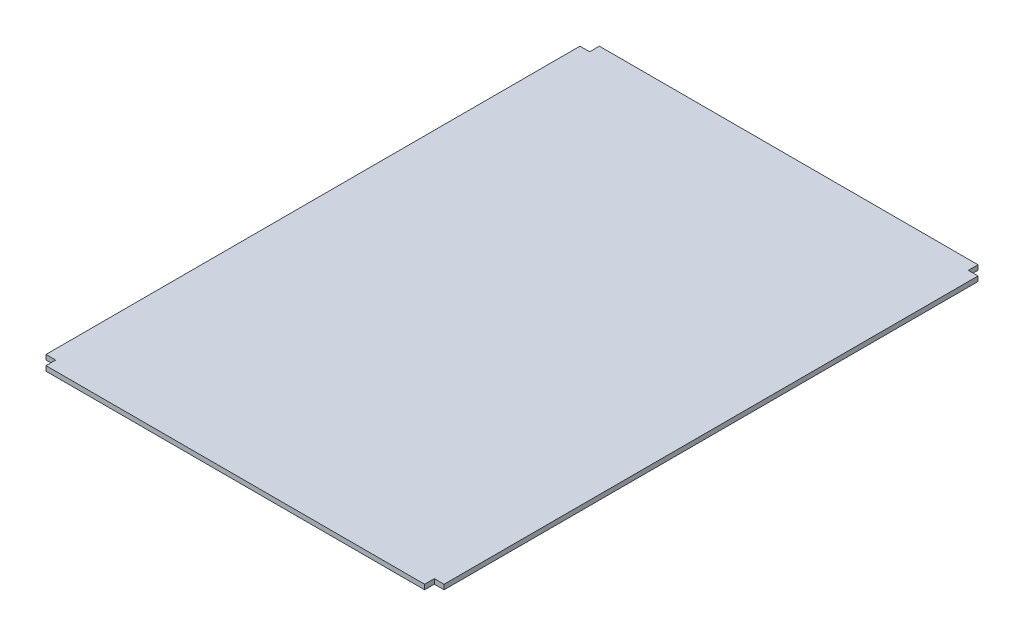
SolidWorks part; units mm, degrees
ref_plane "Front Plane" through (0, 0, 0) normal (0, 0, 1) x (1, 0, 0)
ref_plane "Top Plane" through (0, 0, 0) normal (0, 1, 0) x (1, 0, 0)
ref_plane "Right Plane" through (0, 0, 0) normal (1, 0, 0) x (0, 0, -1)
sketch "Sketch1" plane through (0, 0, 0) normal (0, 1, 0) x (1, 0, 0)
  line L1 (-260.35, -361.95) -> (260.35, -361.95)
  line L2 (-260.35, -361.95) -> (-260.35, 361.95)
  line L3 (-260.35, 361.95) -> (260.35, 361.95)
  line L4 (260.35, -361.95) -> (260.35, 361.95)
  line L5 (-260.35, -361.95) -> (260.35, 361.95) construction
  line L6 (-260.35, 361.95) -> (260.35, -361.95) construction
  point P0 (0, 0)
  dimension "D1" = 723.9
  dimension "D2" = 520.7
extrude "Boss-Extrude1" add sketch "Sketch1" along normal blind 6.35
sketch "Sketch2" plane through (0, 6.35, 0) normal (0, 1, 0) x (1, 0, 0)
  line L1 (-260.35, -361.95) -> (-247.65, -361.95)
  line L2 (-260.35, -361.95) -> (-260.35, -349.25)
  line L3 (-260.35, -349.25) -> (-247.65, -349.25)
  line L4 (-247.65, -361.95) -> (-247.65, -349.25)
  dimension "D1" = 12.7
  dimension "D2" = 12.7
extrude "Cut-Extrude1" cut sketch "Sketch2" against normal through all
sketch "Sketch3" plane through (0, 6.35, 0) normal (0, 1, 0) x (1, 0, 0)
  line L1 (260.35, -361.95) -> (247.65, -361.95)
  line L2 (260.35, -361.95) -> (260.35, -349.25)
  line L3 (260.35, -349.25) -> (247.65, -349.25)
  line L4 (247.65, -361.95) -> (247.65, -349.25)
  line L5 (260.35, 361.95) -> (247.65, 361.95)
  line L6 (260.35, 361.95) -> (260.35, 349.25)
  line L7 (260.35, 349.25) -> (247.65, 349.25)
  line L8 (247.65, 361.95) -> (247.65, 349.25)
  line L9 (-260.35, 361.95) -> (-247.65, 361.95)
  line L10 (-260.35, 361.95) -> (-260.35, 349.25)
  line L11 (-260.35, 349.25) -> (-247.65, 349.25)
  line L12 (-247.65, 361.95) -> (-247.65, 349.25)
  dimension "D1" = 12.7
  dimension "D2" = 12.7
  dimension "D3" = 12.7
  dimension "D4" = 12.7
  dimension "D5" = 12.7
  dimension "D6" = 12.7
extrude "Cut-Extrude2" cut sketch "Sketch3" against normal through all
